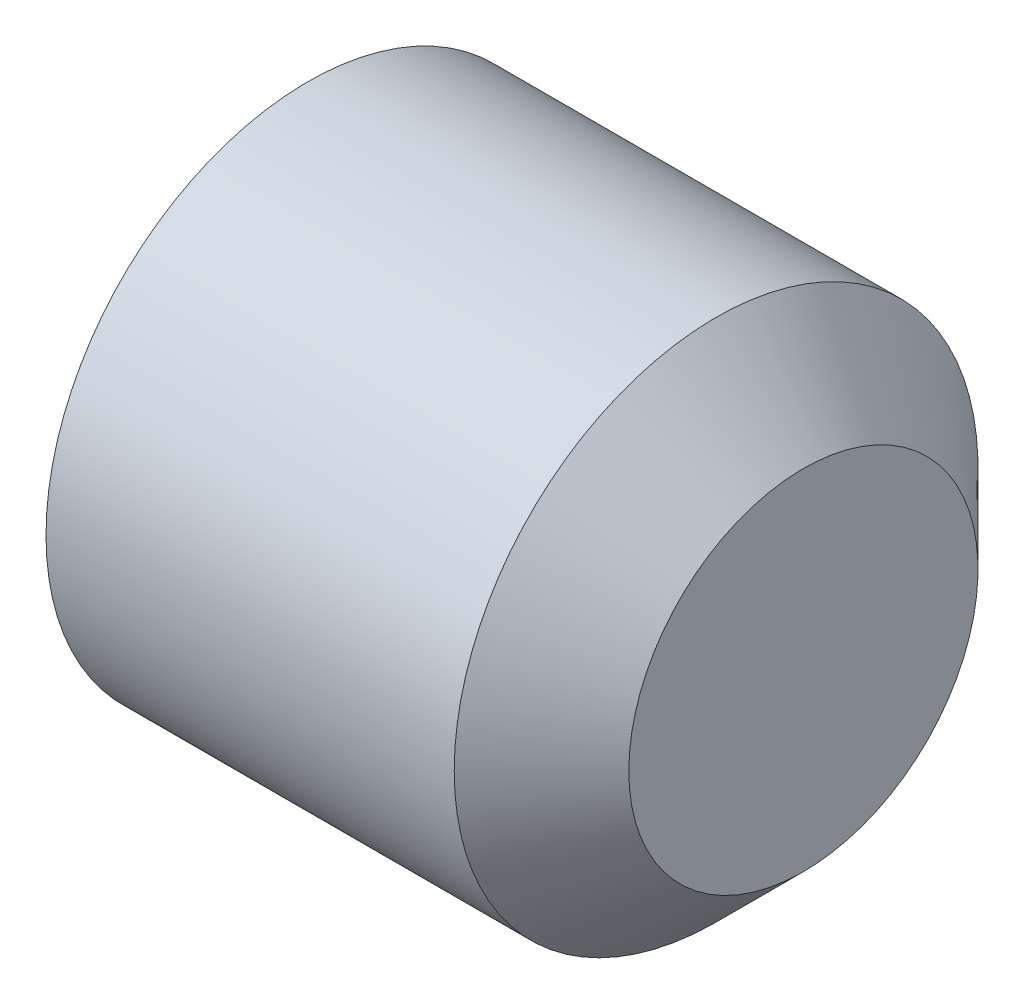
SolidWorks part; units mm, degrees
ref_plane "Plane1" through (0, 0, 0) normal (0, 0, 1) x (1, 0, 0)
ref_plane "Plane2" through (0, 0, 0) normal (0, 1, 0) x (1, 0, 0)
ref_plane "Plane3" through (0, 0, 0) normal (1, 0, 0) x (0, 0, -1)
revolve "BaseBody" add sketch "BodySke" angle 360 about L5
sketch "BodySke" plane through (0, 0, 0) normal (0, 0, 1) x (1, 0, 0)
  line L0 (0, 0) -> (0, 1.2195)
  line L1 (0, 1.2195) -> (0.1619, 1.5)
  line L2 (0.1619, 1.5) -> (2.5, 1.5)
  line L3 (2.5, 1.5) -> (3, 1)
  line L4 (3, 0) -> (0, 0)
  line L5 (-12.7, 0) -> (88.9, 0) construction
  line L6 (3, 1) -> (3, 0)
  line L7 (3, 1) -> (3, 10.525) construction
  line L8 (0, -1.2195) -> (0.1619, -1.5) construction
  line L9 (0.5, 15.875) -> (0.5, -3.175) construction
  line L10 (2.5, -1.5) -> (3, -1) construction
  dimension "Length" = 3
  dimension "Diameter" = 3
  dimension "Drive_ch_ang" = 60
  dimension "Minor_dia" = 2.439
  dimension "Cup_nose_ang" = 45
  dimension "Cup_dia" = 2
  dimension "Advance" = 0.5
sketch "Sketch2" plane through (0, 0, 0) normal (-1, 0, 0) x (0, 0, 1)
  line L0 (0.433, 0.75) -> (-0.433, 0.75)
  line L1 (-0.433, 0.75) -> (-0.866, 0)
  line L2 (0.433, 0.75) -> (0.866, 0)
  line L3 (0.433, -0.75) -> (0.866, 0)
  line L4 (0.433, -0.75) -> (-0.433, -0.75)
  line L5 (-0.433, -0.75) -> (-0.866, 0)
  dimension "Hex_size" = 1.5
  dimension "D2" = 0.75
  dimension "D3" = 0.75
extrude "Hex" cut sketch "Sketch2" against normal blind 1.2
sketch "ThdSchSke" plane through (0, 0, 0) normal (0, 0, 1) x (1, 0, 0)
  line L0 (0.1619, -1.2195) -> (-0.0345, -1.5)
  line L1 (0.1619, -1.2195) -> (0.3584, -1.5)
  line L2 (0.3584, -1.5) -> (0.3584, -1.875)
  line L3 (-3.175, 0) -> (5.1513, 0) construction
  line L5 (0.3584, -1.875) -> (-0.0345, -1.875)
  line L6 (-0.0345, -1.875) -> (-0.0345, -1.5)
  line L8 (0.1619, 1.5) -> (0.1619, -1.5) construction
  dimension "Thread_minor" = 2.439
  dimension "Diameter" = 3
  dimension "SideAngle" = 55
  dimension "VeeAngle" = 70
  dimension "Overcut" = 3.75
revolve "ThreadSchematic" [suppressed] cut sketch "ThdSchSke" angle 360 about L3
pattern_linear "ThdSchPat" [suppressed]
equation "\"D2@Sketch2\" = \"Hex_size@Sketch2\" / 2"
equation "\"D3@Sketch2\" = \"Hex_size@Sketch2\" / 2"
equation "\"Thread_minor@ThreadCosmetic\" = \"Minor_dia@BodySke\""
equation "\"Thread_minor@ThdSchSke\" = \"Thread_minor@ThreadCosmetic\""
equation "\"Diameter@ThdSchSke\" = \"Diameter@BodySke\""
equation "\"Overcut@ThdSchSke\" = \"Diameter@BodySke\" * 1.25"
equation "\"Num_threads@ThdSchPat\" = int( (\"Length@BodySke\" - ( ( ( \"Diameter@BodySke\" - \"Minor_dia@BodySke\" ) * 0.5 ) / tan( \"Drive_ch_ang@BodySke\" * 0.017453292 ) ) - ( ( ( \"Diameter@BodySke\" - \"Cup_dia@BodySk"
equation "\"Advance@ThdSchPat\" = (\"Length@BodySke\" - ( ( ( \"Diameter@BodySke\" - \"Minor_dia@BodySke\" ) * 0.5 ) / tan( \"Drive_ch_ang@BodySke\" * 0.017453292 ) ) - ( ( ( \"Diameter@BodySke\" - \"Cup_dia@BodySke\" ) * 0."
equation "' \"Num_threads@ThdSchPat\" = \"Num_threads@ThdSchPat\" - sgn( \"Num_threads@ThdSchPat\" - 1) '---chamfered tips only---"
